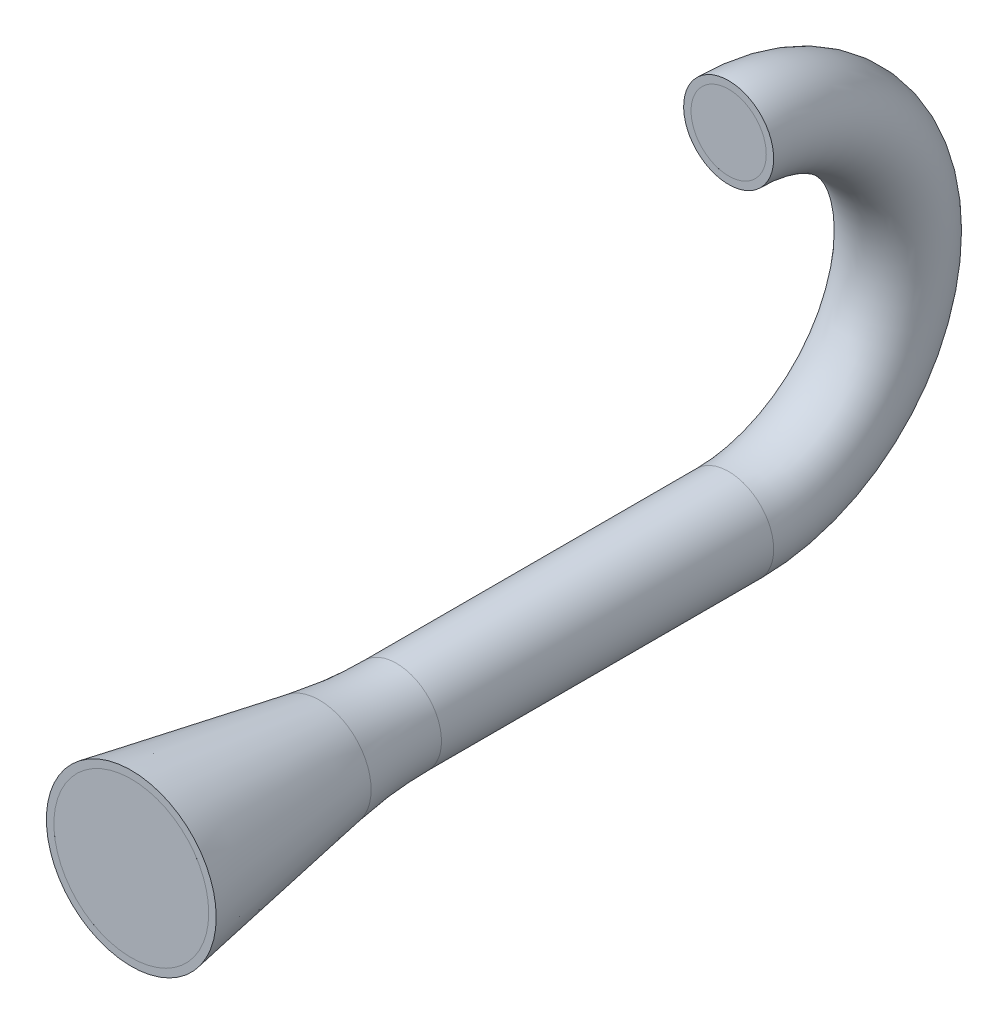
SolidWorks part; units mm, degrees
ref_plane "Front" through (0, 0, 0) normal (0, 0, 1) x (1, 0, 0)
ref_plane "Top" through (0, 0, 0) normal (0, 1, 0) x (1, 0, 0)
ref_plane "Right"
sketch "Sketch1" plane through (0, 0, 0) normal (1, 0, 0) x (0, 0, -1)
  line L0 (0, 59.2726) -> (0, -59.2726) construction
  line L1 (826.6455, 311.0428) -> (47623.5202, 17919.3511) construction
  line L2 (-251.0054, -114.3) -> (0, -114.3)
  arc A0 (0, 114.3) -> (0, -114.3) centre (0, 0) cw
  dimension "D2" = 114.3
sketch "Sketch3" plane through (0, 0, 0) normal (0, 0, 1) x (1, 0, 0)
  circle A0 centre (0, 114.3) radius 25.4
  dimension "D1" = 50.8
ref_plane "Plane1" through (0, -127, 0) normal (0, 1, 0) x (-1, 0, 0)
sweep "Sweep1" add profiles "Sketch3" path "Sketch1"
sketch "Sketch9" plane through (0, 0, 251.0054) normal (0, 0, 1) x (1, 0, 0)
  circle A0 centre (0, -114.3) radius 25.4
extrude "Extrude3" add sketch "Sketch9" along normal blind 152.4 draft 10
fillet "Fillet2" radius 304.8 1 edges at (25.4, -114.3, 251.0054)
shell "Shell4" thickness 5
sketch "Sketch10" plane through (0, 0, 0) normal (0, 0, 1) x (1, 0, 0)
  line L0 (-15.6576, -94.3) -> (15.6576, -94.3)
  circle A0 centre (0, -114.3) radius 25.4 construction
  arc A1 (-15.6576, -94.3) -> (15.6576, -94.3) centre (0, -114.3) ccw
  dimension "D1" = 20
extrude "Boss-Extrude1" add sketch "Sketch10" along normal blind 10
sketch3d "3DSketch1"
  circle A0 centre (0, -114.3, 224.3389) radius 30.4 construction
  point P0 (0, -114.3, 224.3389)
  point P4 (0, -114.3, 193.9389)
ref_plane "Plane2" through (0, 0, 224.3389) normal (0, 0, 1) x (1, 0, 0)
sketch "Sketch11" plane through (0, 0, 224.3389) normal (0, 0, 1) x (1, 0, 0)
  line L0 (-25.4, -114.3) -> (25.4, -114.3)
  circle A0 centre (0, -114.3) radius 25.4 construction
  arc A1 (25.4, -114.3) -> (-25.4, -114.3) centre (0, -114.3) ccw
extrude "Boss-Extrude2" add sketch "Sketch11" against normal blind 3
imported_body "LID1"
imported_body "LID2"
